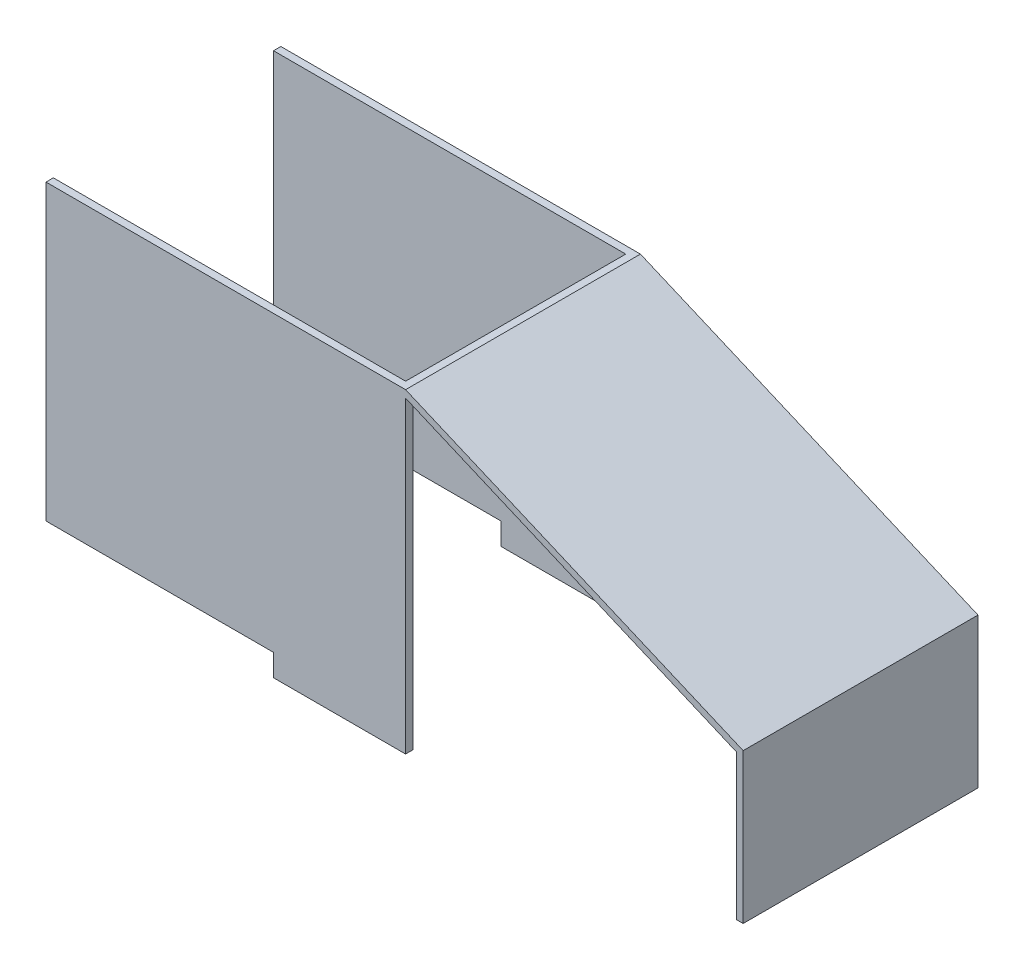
SolidWorks part; units mm, degrees
ref_plane "Front Plane" through (0, 0, 0) normal (0, 0, 1) x (1, 0, 0)
ref_plane "Top Plane" through (0, 0, 0) normal (0, 1, 0) x (1, 0, 0)
ref_plane "Right Plane" through (0, 0, 0) normal (1, 0, 0) x (0, 0, -1)
sketch "Croquis1" plane through (0, 0, 0) normal (0, 1, 0) x (1, 0, 0)
  line L0 (-12, 7.5) -> (12, 7.5)
  line L1 (-12, 8) -> (12.5, 8)
  line L2 (-12, -7.5) -> (-12, -8)
  line L3 (-12, -8) -> (12.5, -8)
  line L4 (12.5, 8) -> (12.5, -8)
  line L5 (-12, 7.68) -> (12.5, -8) construction
  line L6 (-12, -7.68) -> (12.5, 8) construction
  line L7 (12, 7.5) -> (12, -7.5)
  line L8 (-12, -7.5) -> (12, -7.5)
  line L9 (-12.5, -8) -> (12.5, -8) construction
  line L10 (-12, 8) -> (-12, 7.5)
  line L11 (-12.5, 8) -> (12.5, 8) construction
  line L12 (-12.5, 8) -> (-12.5, -8) construction
  line L13 (-12, 7.5) -> (-12, -7.5) construction
  point P0 (0, 0)
  dimension "D3" = 0.5
extrude "Saliente-Extruir1" add sketch "Croquis1" along normal blind 20
sketch "Croquis2" plane through (0, 0, 8) normal (0, 0, 1) x (1, 0, 0)
  line L0 (3.5, 0) -> (12.5, 0)
  line L1 (-12, 0) -> (12.5, 0) construction
  line L2 (3.5, 0) -> (3.5, -10)
  line L3 (3.5, -10) -> (12.5, -10)
  line L4 (12.5, 0) -> (12.5, -10)
  dimension "D1" = 9
  dimension "D2" = 10
extrude "Saliente-Extruir2" add sketch "Croquis2" against normal up to surface (16 mm away)
sketch "Croquis4" plane through (0, -10, 0) normal (0, -1, 0) x (1, 0, 0)
  line L4 (-12, 7.5) -> (12, 7.5)
  line L5 (-12, 7.5) -> (-12, -7.5)
  line L6 (-12, -7.5) -> (12, -7.5)
  line L7 (12, 7.5) -> (12, -7.5)
  line L8 (-12, 7.5) -> (12, -7.5) construction
  line L9 (-12, -7.5) -> (12, 7.5) construction
  point P0 (0, 0)
  dimension "D1" = 15
  dimension "D2" = 24
extrude "Cortar-Extruir1" cut sketch "Croquis4" against normal up to surface (30 mm away)
sketch "Croquis5" plane through (12.5, 0, 0) normal (1, 0, 0) x (0, 0, -1)
  line L0 (-7.5, 19.5) -> (-7.5, -10)
  line L1 (7.5, 19.5) -> (7.5, -10)
  line L2 (7.5, -10) -> (-7.5, -10)
  line L3 (-8, 20) -> (8, 20) construction
  line L4 (-7.5, 19.5) -> (7.5, 19.5)
  dimension "D1" = 0.5
extrude "Cortar-Extruir2" cut sketch "Croquis5" against normal up to surface (9 mm away) contours L2 L0 L4 L1
sketch "Croquis7" plane through (0, 0, 8) normal (0, 0, 1) x (1, 0, 0)
  line L0 (12.5, 20) -> (35.5, 10.202)
  line L1 (12.5, 0) -> (35.5, 0) construction
  line L2 (12.5, 20) -> (12.5, -10) construction
  line L3 (12.5, 19.5) -> (35.04, 9.898)
  line L4 (35.5, 10.202) -> (35.5, 0)
  line L5 (35.04, 9.898) -> (35.04, 0)
  line L6 (35.04, 0) -> (35.5, 0)
  line L7 (12.5, 20) -> (12.5, 19.5)
  dimension "D1" = 25
  dimension "D2" = 23
  dimension "D3" = 24.5
  dimension "D4" = 20
extrude "Saliente-Extruir3" add sketch "Croquis7" against normal up to surface (16 mm away)
sketch "Croquis9" plane through (12.5, 0, 0) normal (1, 0, 0) x (0, 0, -1)
  line L0 (-8, 19.5) -> (-8, -10) construction
  line L1 (-8, -1.5) -> (8, -1.5)
  line L2 (-8, -1.5) -> (-8, -10)
  line L3 (-8, -10) -> (8, -10)
  line L4 (8, -1.5) -> (8, -10)
  dimension "D1" = 8.5
extrude "Cortar-Extruir3" cut sketch "Croquis9" against normal up to surface (9 mm away)
